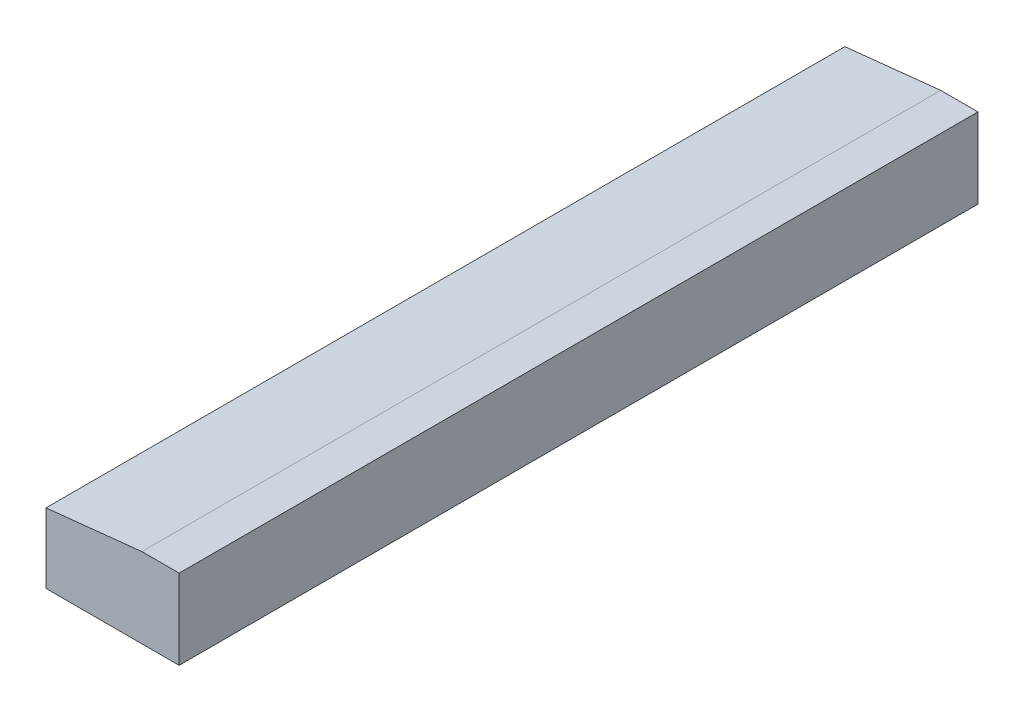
SolidWorks part; units mm, degrees
ref_plane "Plan de face" through (0, 0, 0) normal (0, 0, 1) x (1, 0, 0)
ref_plane "Plan de dessus" through (0, 0, 0) normal (0, 1, 0) x (1, 0, 0)
ref_plane "Plan de droite" through (0, 0, 0) normal (1, 0, 0) x (0, 0, -1)
sketch "Esquisse1" plane through (0, 0, 0) normal (0, 0, 1) x (1, 0, 0)
  line L0 (-7.0556, 0) -> (61.1481, 0) construction
  line L1 (0, 21.637) -> (0, -13.4056) construction
  line L2 (25, -13.4056) -> (25, 27.7519) construction
  line L3 (61.1481, 15) -> (-8.937, 15) construction
  line L5 (18, 16.9984) -> (18, 13.5649) construction
  line L6 (0, 13.1081) -> (18, 15)
  line L7 (18, 15) -> (25, 15)
  line L8 (25, 15) -> (25, 0)
  line L9 (25, 0) -> (0, 0)
  line L10 (0, 0) -> (0, 13.1081)
  dimension "D1" = 25
  dimension "D2" = 15
  dimension "D3" = 7
  dimension "D4" = 6
extrude "Extrusion1" add sketch "Esquisse1" along normal blind 150
